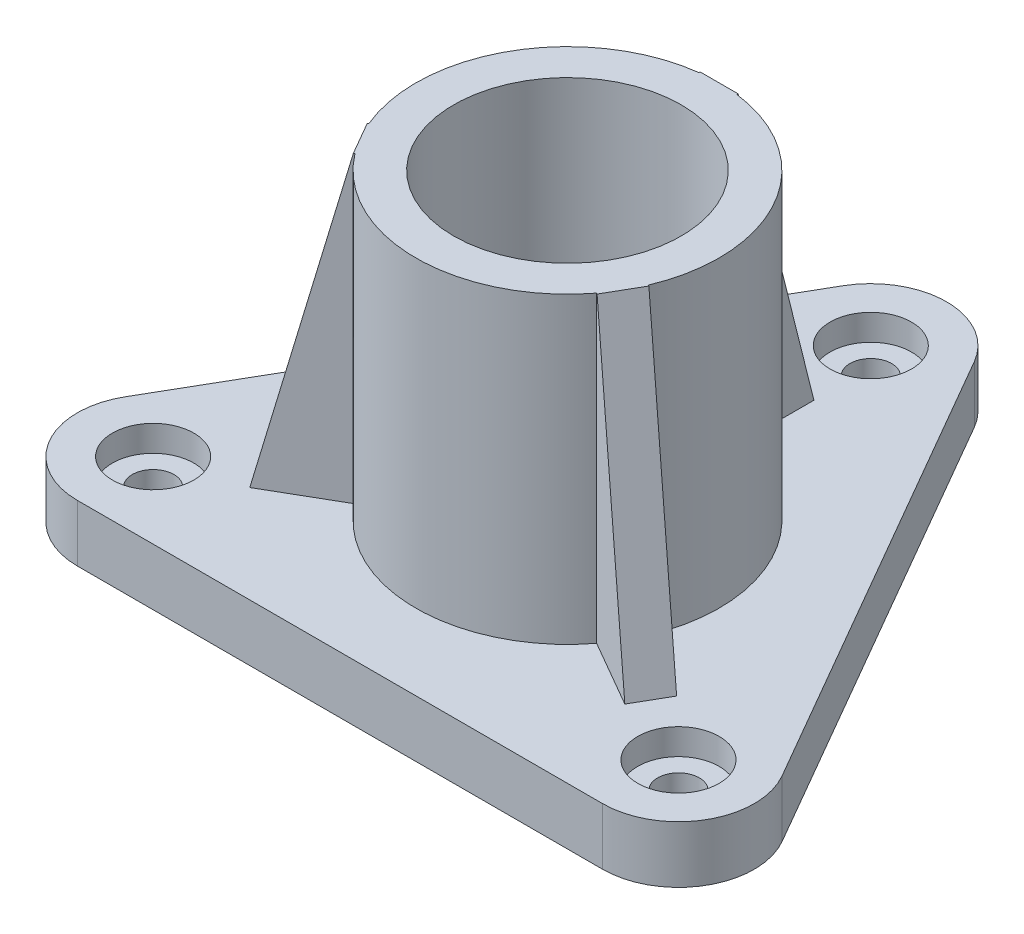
SolidWorks part; units mm, degrees
ref_plane "Front Plane" through (0, 0, 0) normal (0, 0, 1) x (1, 0, 0)
ref_plane "Top Plane" through (0, 0, 0) normal (0, 1, 0) x (1, 0, 0)
ref_plane "Right Plane" through (0, 0, 0) normal (1, 0, 0) x (0, 0, -1)
sketch "Sketch1" plane through (0, 0, 0) normal (0, 1, 0) x (1, 0, 0)
  line L1 (-17.3205, 90) -> (-86.6025, -30)
  line L2 (-69.282, -60) -> (69.282, -60)
  line L3 (86.6025, -30) -> (17.3205, 90)
  circle A0 centre (0, 0) radius 60 construction
  arc A1 (-69.282, -60) -> (-86.6025, -30) centre (-69.282, -40) cw
  arc A2 (86.6025, -30) -> (69.282, -60) centre (69.282, -40) cw
  arc A3 (17.3205, 90) -> (-17.3205, 90) centre (0, 80) ccw
  circle A4 centre (0, 0) radius 30
  point P12 (0, 120)
  dimension "D1" = 120
  dimension "D2" = 20
  dimension "D3" = 60
extrude "Extrude1" add sketch "Sketch1" along normal blind 15
sketch "Sketch2" plane through (0, 15, 0) normal (0, 1, 0) x (-1, 0, 0)
  circle A0 centre (0, 0) radius 30 construction
  circle A1 centre (0, 0) radius 30
  circle A2 centre (0, 0) radius 40
  dimension "D1" = 10
extrude "Extrude2" add sketch "Sketch2" along normal blind 80
hole_wizard "CBORE for M10 Hex Head Bolt1" positions "Sketch5" profile "Sketch4" counterbore size "M10" standard "Ansi Metric"
sketch "Sketch5" plane through (0, 15, 0) normal (0, 1, 0) x (-1, 0, 0)
  point P0 (69.282, 40)
  point P1 (0, -80)
  point P4 (-69.282, 40)
sketch "Sketch4" plane through (-69.282, 15, 40) normal (1, 0, 0) x (0, 0, 1)
  line L0 (0, 0) -> (0, 15)
  line L1 (0, 15) -> (5.5, 15)
  line L3 (5.5, 15) -> (5.5, 6.85)
  line L4 (5.5, 6.85) -> (10.74, 6.85)
  line L5 (10.74, 6.85) -> (10.74, 0)
  line L7 (10.74, 0) -> (0, 0)
  line L11 (0, -6.35) -> (0, 107.95) construction
  dimension "Thru Hole Dia." = 11
  dimension "Thru Hole Depth" = 15
  dimension "C'Bore Dia." = 21.48
  dimension "C'Bore Depth" = 6.85
sketch "Sketch3" plane through (0, 0, 0) normal (1, 0, 0) x (0, 0, -1)
  line L0 (40, 95) -> (60, 15)
  line L1 (-30, 15) -> (90, 15) construction
  line L2 (40, 15) -> (40, 95) construction
  line L3 (40, 95) -> (30, 95)
  line L4 (40, 95) -> (-40, 95) construction
  line L5 (30, 95) -> (30, 15)
  line L6 (30, 15) -> (60, 15)
  line L7 (30, 0) -> (30, 95) construction
  dimension "D1" = 20
extrude "Extrude3" add sketch "Sketch3" along normal mid plane 10
pattern_circular "CirPattern1" count 3 over 360 about axis through (0, 0, 0) along (0, 1, 0) of "Extrude3"
